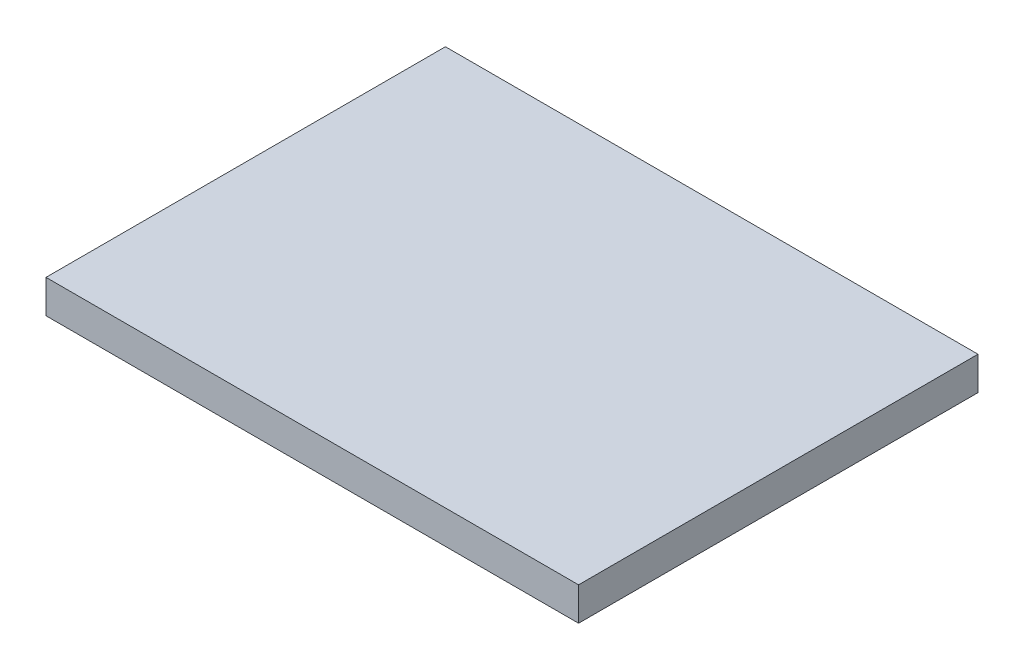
SolidWorks part; units mm, degrees
ref_plane "Front Plane" through (0, 0, 0) normal (0, 0, 1) x (1, 0, 0)
ref_plane "Top Plane" through (0, 0, 0) normal (0, 1, 0) x (1, 0, 0)
ref_plane "Right Plane" through (0, 0, 0) normal (1, 0, 0) x (0, 0, -1)
sketch "Sketch1" plane through (0, 0, 0) normal (0, 1, 0) x (1, 0, 0)
  line L1 (-152.4, 152.4) -> (152.4, 152.4)
  line L2 (-152.4, 152.4) -> (-152.4, -76.2)
  line L3 (-152.4, -76.2) -> (152.4, -76.2)
  line L4 (152.4, 152.4) -> (152.4, -76.2)
  dimension "D1" = 228.6
  dimension "D2" = 304.8
  dimension "D3" = 152.4
  dimension "D4" = 76.2
extrude "Boss-Extrude1" add sketch "Sketch1" along normal blind 19.05
